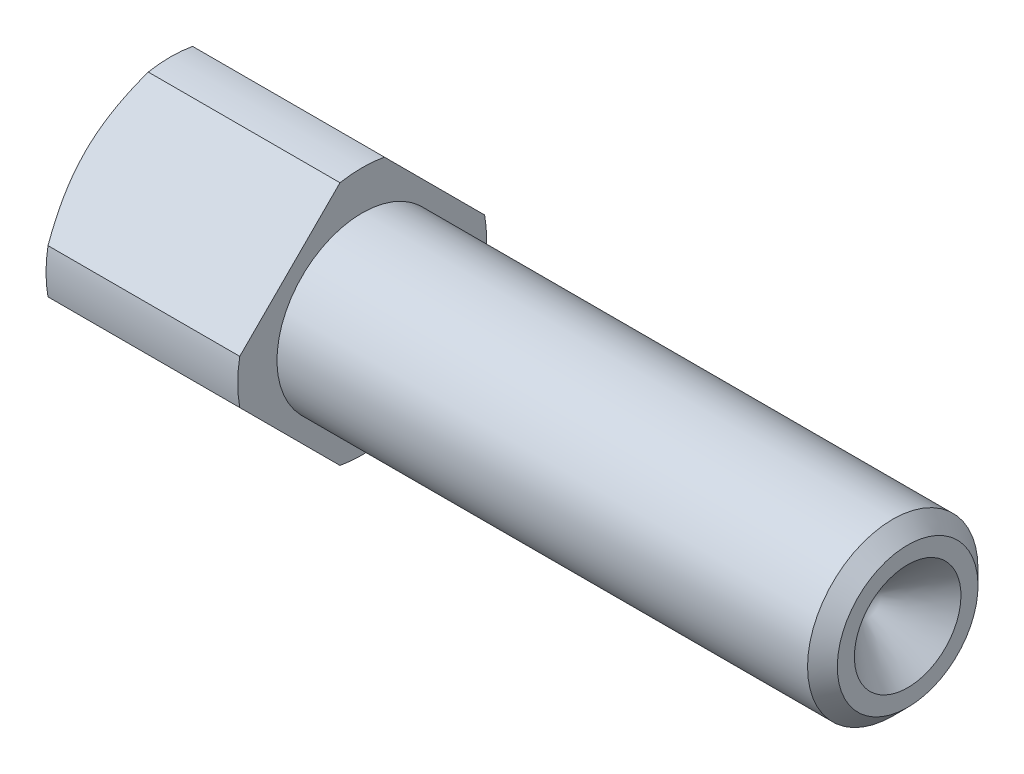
SolidWorks part; units mm, degrees
ref_plane "Front" through (0, 0, 0) normal (0, 0, 1) x (1, 0, 0)
ref_plane "Top" through (0, 0, 0) normal (0, 1, 0) x (1, 0, 0)
ref_plane "Right" through (0, 0, 0) normal (1, 0, 0) x (0, 0, -1)
sketch "Sketch1" plane through (0, 0, 0) normal (1, 0, 0) x (0, 0, -1)
  circle A0 centre (0, 0) radius 3.65
  dimension "e" = 7.3
extrude "BaseHead" add sketch "Sketch1" along normal blind 6
sketch "Sketch2" plane through (0, -2.2415, -0.2463) normal (-1, 0, 0) x (0, 0, 1)
  line L1 (4.4889, 2.2415) -> (0.2463, 6.4841)
  line L2 (0.2463, 6.4841) -> (-3.9963, 2.2415)
  line L3 (-3.9963, 2.2415) -> (0.2463, -2.0012)
  line L4 (0.2463, -2.0012) -> (4.4889, 2.2415)
  circle A0 centre (0.2463, 2.2415) radius 3 construction
  dimension "s" = 6
extrude "Cut-Extrude1" cut sketch "Sketch2" against normal blind 6 flip side to cut
sketch "Sketch3" plane through (1.2597, -5.2747, 0) normal (0, 0, 1) x (0, -1, 0)
  line L0 (-9.2897, -1.2597) -> (-8.2747, -1.2597)
  line L2 (-8.2747, -1.2597) -> (-9.2897, -0.6737)
  line L3 (-9.2897, -0.6737) -> (-9.2897, -1.2597)
  line L4 (-5.2747, 0.2856) -> (-5.2747, -6.82) construction
  line L6 (-8.8662, -1.2597) -> (-5.9259, -1.2597) construction
  dimension "D1" = 8.03
  dimension "d2" = 6
  dimension "D3" = 30
revolve "Cut-Revolve1" cut sketch "Sketch3" angle 360 about L4
sketch "Sketch4" plane through (-10.3472, 12.8472, 0) normal (0, 0, 1) x (0, -1, 0)
  line L0 (12.8472, 16.3472) -> (15.3472, 16.3472)
  line L1 (15.3472, 32.3472) -> (14.4106, 32.3472)
  line L2 (15.3472, 16.3472) -> (15.3472, 32.3472)
  line L3 (14.4106, 32.3472) -> (12.8472, 30.7839)
  line L4 (9.2558, 16.3472) -> (12.196, 16.3472) construction
  line L5 (12.8472, 30.7839) -> (12.8472, 16.3472)
  line L6 (12.8472, 24.434) -> (12.8472, -1.2396) construction
  dimension "D1" = 45
  dimension "d" = 5
  dimension "l" = 16
  dimension "dz" = 3.1267
revolve "BaseBody" add sketch "Sketch4" angle 360 about L6
fillet "HeadFillet" [suppressed] radius 0.2
chamfer "Chamfer1" distance 0.4367 angle 45 1 edges at (22, 2.5, 0)
sketch "Sketch8" plane through (0, 0, 0) normal (0, 0, 1) x (1, 0, 0)
  line L0 (16, 2.067) -> (16.25, 2.5)
  line L1 (16.25, 2.5) -> (16.25, 3)
  line L2 (16.25, 3) -> (15.75, 3)
  line L3 (15.75, 3) -> (15.75, 2.5)
  line L4 (15.75, 2.5) -> (16, 2.067)
  line L5 (0, 0) -> (18.2989, 0) construction
  line L6 (0, 2.1213) -> (0, -2.1213) construction
  line L7 (22, -2.0633) -> (22, 2.0633) construction
  dimension "D1" = 5
  dimension "ss" = 0.5
  dimension "D3" = 6
revolve "Cut-Revolve10" [suppressed] cut sketch "Sketch8" angle 360 about L5
pattern_linear "LPattern10" [suppressed] count 10 spacing 0.6 along (1, 0, 0)
equation "\"d2@Sketch3\" = \"s@Sketch2\""
equation "\"D1@Sketch3\" = \"e@Sketch1\" * 1.1"
equation "\"k+c@BaseHead\" = \"k@Cut-Extrude1\""
equation "\"D1@Chamfer1\" = \"d@Sketch4\" / 2 - \"dz@Sketch4\" / 2-0.5"
equation "\"D1@Sketch8\" = \"d@Sketch4\""
equation "\"D3@Sketch8\" = \"D1@ThreadCosmetic1\""
equation "\"ss@Sketch8\" =  ( \"d@Sketch4\" - \"d@ThreadCosmetic1\" )  / 2"
equation "\"D3@LPattern10\" = \"ss@Sketch8\" * 1.2"
equation "\"D1@LPattern10\" = \"D1@ThreadCosmetic1\" / \"D3@LPattern10\""
